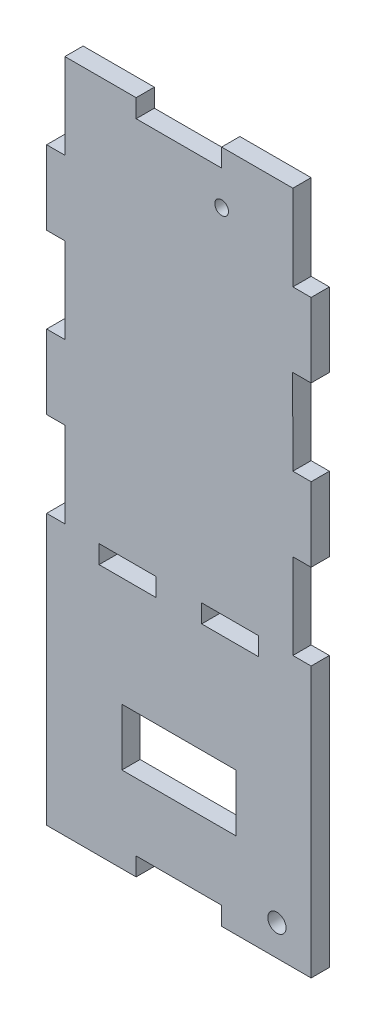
SolidWorks part; units mm, degrees
ref_plane "Front Plane" through (0, 0, 0) normal (0, 0, 1) x (1, 0, 0)
ref_plane "Top Plane" through (0, 0, 0) normal (0, 1, 0) x (1, 0, 0)
ref_plane "Right Plane" through (0, 0, 0) normal (1, 0, 0) x (0, 0, -1)
sketch "Sketch1" plane through (0, 0, 0) normal (0, 0, 1) x (1, 0, 0)
  line L0 (204, 255) -> (204, 180)
  line L1 (220, 164) -> (220, 102.9999)
  line L2 (-12, 164) -> (-12, 180)
  line L3 (204, 535) -> (141.5, 535)
  line L4 (-12, 164) -> (-12, 102.9999)
  line L5 (220, 395) -> (220, 460)
  line L6 (220, 255.0003) -> (220, 320.0003)
  line L7 (-12, 102.9999) -> (-12, -36.9999)
  line L8 (220, -57) -> (141.5, -57)
  line L9 (220, 180) -> (204, 180)
  line L10 (54, 18) -> (154, 18)
  line L11 (66.5, -57) -> (66.5, -41)
  line L12 (220, 102.9999) -> (220, -36.9999)
  line L14 (54, 68) -> (154, 68)
  line L15 (-12, 460) -> (4, 460)
  line L16 (4, 535) -> (4, 460)
  line L17 (-12, 395) -> (4.2101, 395)
  line L18 (-12, 320.0003) -> (4, 320.0003)
  line L19 (4.2101, 395) -> (4, 320.0003)
  line L20 (220, 255.0003) -> (204, 255)
  line L21 (203.7899, 395) -> (204, 320.0003)
  line L22 (220, 320.0003) -> (204, 320.0003)
  line L23 (-12, 255.0003) -> (4, 255)
  line L24 (220, 395) -> (203.7899, 395)
  line L25 (204, 535) -> (204, 460)
  line L26 (220, 460) -> (204, 460)
  line L27 (-12, 180) -> (4, 180)
  line L28 (-12, 255.0003) -> (-12, 320.0003)
  line L29 (-12, 395) -> (-12, 460)
  line L30 (190, -57) -> (190, -30) construction
  line L31 (4, 255) -> (4, 180)
  line L32 (204, 180) -> (174, 180) construction
  line L33 (4, 180) -> (34, 180) construction
  line L34 (190, -30) -> (220, -30) construction
  line L37 (66.5, -57) -> (-12, -57)
  line L38 (154, 68) -> (154, 18)
  line L39 (174, 180) -> (124, 180)
  line L40 (174, 180) -> (174, 164)
  line L42 (174, 164) -> (124, 164)
  line L43 (124, 180) -> (124, 164)
  line L47 (54, 68) -> (54, 18)
  line L48 (220, -57) -> (220, -36.9999)
  line L49 (34, 180) -> (84, 180)
  line L50 (-12, -57) -> (-12, -36.9999)
  line L51 (220, 164) -> (220, 180)
  line L52 (34, 180) -> (34, 164)
  line L53 (34, 164) -> (84, 164)
  line L54 (84, 180) -> (84, 164)
  line L55 (66.5, 535) -> (4, 535)
  line L58 (66.5, -41) -> (141.5, -41)
  line L59 (141.5, 519) -> (141.5, 489) construction
  line L60 (66.5, 535) -> (66.5, 519)
  line L61 (66.5, 519) -> (141.5, 519)
  line L62 (141.5, 535) -> (141.5, 519)
  line L63 (34, 164) -> (-32.2453, 164) construction
  line L64 (174, 164) -> (259.8085, 164) construction
  line L91 (141.5, -57) -> (141.5, -41)
  circle A0 centre (141.5, 489) radius 6
  circle A1 centre (190, -30) radius 8
extrude "Boss-Extrude2" add sketch "Sketch1" along normal blind 16
equation "\"thk\"= 16mm"
equation "\"D1@Boss-Extrude2\"=\"thk\""
equation "\"D5@Sketch1\"=\"thk\""
equation "\"D29@Sketch1\"=\"thk\""
equation "\"D30@Sketch1\"=\"thk\""
equation "\"D28@Sketch1\"=\"thk\""
equation "\"D6@Sketch1\"=\"thk\""
equation "\"D9@Sketch1\"=\"thk\""
equation "\"D10@Sketch1\"=\"thk\""
equation "\"D27@Sketch1\"=\"thk\""
equation "\"D38@Sketch1\"=\"thk\""
equation "\"D43@Sketch1\"=\"thk\""
